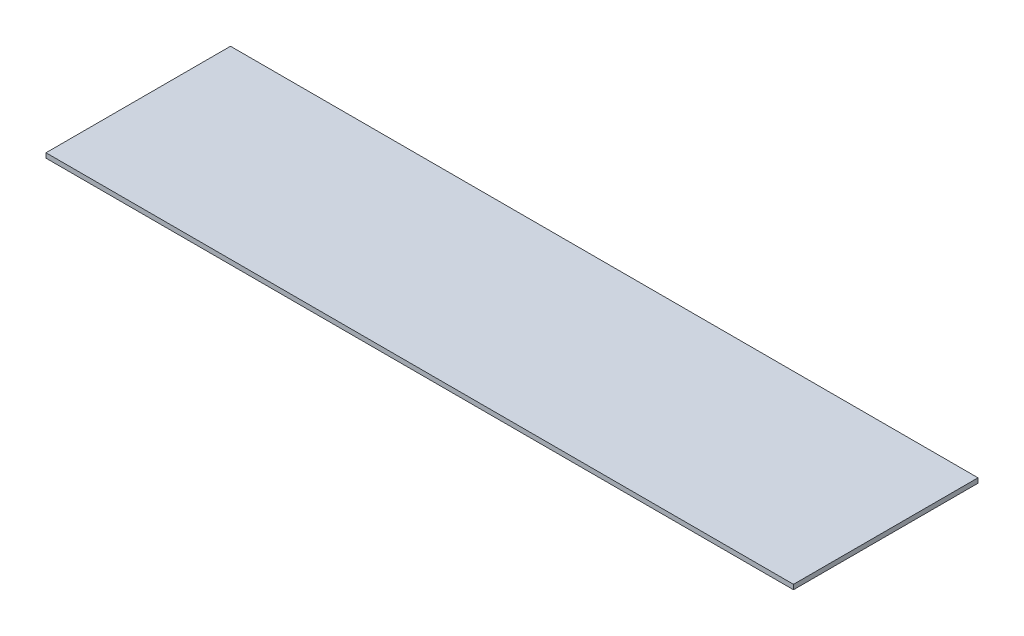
SolidWorks part; units mm, degrees
ref_plane "Front Plane" through (0, 0, 0) normal (0, 0, 1) x (1, 0, 0)
ref_plane "Top Plane" through (0, 0, 0) normal (0, 1, 0) x (1, 0, 0)
ref_plane "Right Plane" through (0, 0, 0) normal (1, 0, 0) x (0, 0, -1)
sketch "Sketch1" plane through (0, 0, 0) normal (0, 1, 0) x (1, 0, 0)
  line L1 (-501.65, -123.825) -> (501.65, -123.825)
  line L2 (-501.65, -123.825) -> (-501.65, 123.825)
  line L3 (-501.65, 123.825) -> (501.65, 123.825)
  line L4 (501.65, -123.825) -> (501.65, 123.825)
  line L5 (-501.65, -123.825) -> (501.65, 123.825) construction
  line L6 (-501.65, 123.825) -> (501.65, -123.825) construction
  point P0 (0, 0)
  dimension "D1" = 1003.3
  dimension "D2" = 247.65
extrude "Boss-Extrude1" add sketch "Sketch1" along normal blind 6.35
